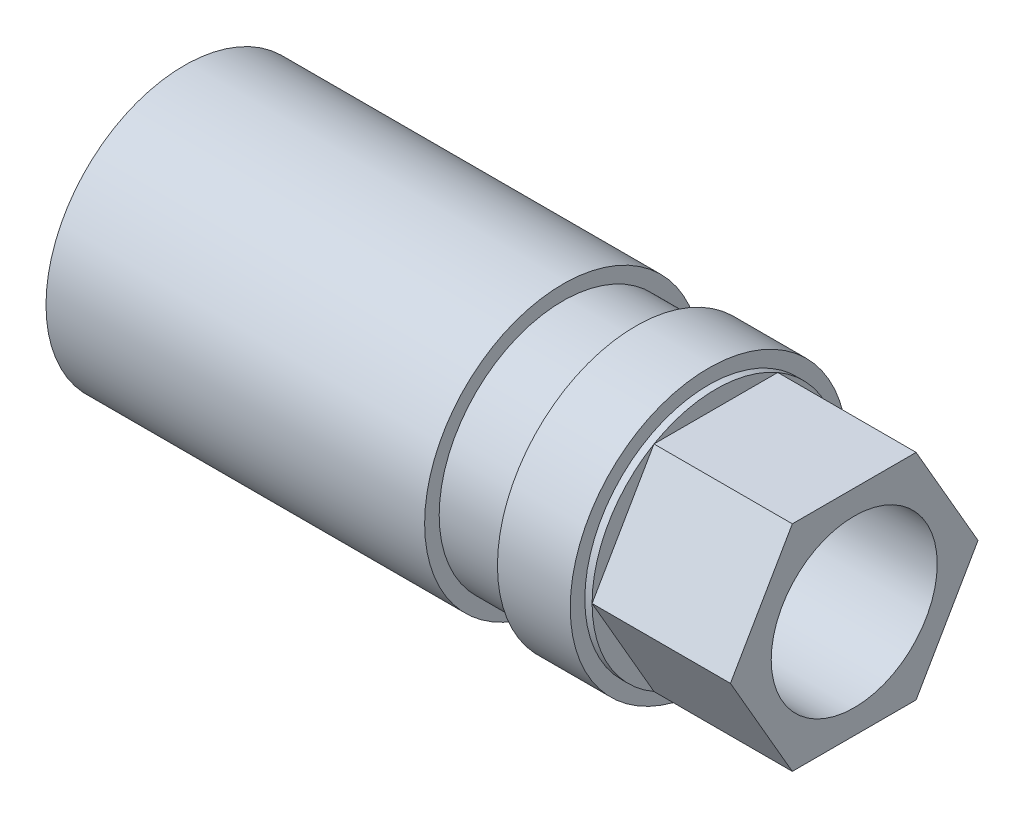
SolidWorks part; units mm, degrees
ref_plane "Alzado" through (0, 0, 0) normal (0, 0, 1) x (1, 0, 0)
ref_plane "Planta" through (0, 0, 0) normal (0, 1, 0) x (1, 0, 0)
ref_plane "Vista lateral" through (0, 0, 0) normal (1, 0, 0) x (0, 0, -1)
sketch "Croquis1" plane through (0, 0, 0) normal (0, 0, 1) x (1, 0, 0)
  line L0 (0, 0) -> (28.336, 0) construction
  line L1 (0, 0) -> (0, 9.5)
  line L2 (0, 9.5) -> (26, 9.5)
  line L3 (26, 9.5) -> (26, 8.5)
  line L4 (26, 8.5) -> (31, 8.5)
  line L5 (31, 8.5) -> (31, 9.5)
  line L6 (31, 9.5) -> (36, 9.5)
  line L7 (36, 9.5) -> (36, 8.5)
  line L8 (36, 8.5) -> (36.5, 8.5)
  line L9 (36.5, 8.5) -> (36.5, 0)
  line L10 (36.5, 0) -> (0, 0)
  dimension "D1" = 19
  dimension "D2" = 26
  dimension "D3" = 1
  dimension "D4" = 5
  dimension "D5" = 0.5
revolve "Revolución1" add sketch "Croquis1" angle 360 about L0
sketch "Croquis2" plane through (36.5, 0, 0) normal (1, 0, 0) x (0, 0, -1)
  line L1 (-4.2499, 7.3613) -> (-8.5, 0.0001)
  line L2 (-8.5, 0.0001) -> (-4.2501, -7.3612)
  line L3 (-4.2501, -7.3612) -> (4.2499, -7.3613)
  line L4 (4.2499, -7.3613) -> (8.5, -0.0001)
  line L5 (8.5, -0.0001) -> (4.2501, 7.3612)
  line L6 (4.2501, 7.3612) -> (-4.2499, 7.3613)
  circle A0 centre (0, 0) radius 7.3612 construction
  dimension "D1" = 17
extrude "Saliente-Extruir1" add sketch "Croquis2" along normal blind 9.5
sketch "Croquis3" plane through (46, 0, 0) normal (1, 0, 0) x (0, 0, -1)
  circle A0 centre (0, 0) radius 5.7
  dimension "D1" = 11.4
extrude "Cortar-Extruir1" cut sketch "Croquis3" against normal blind 9.5
